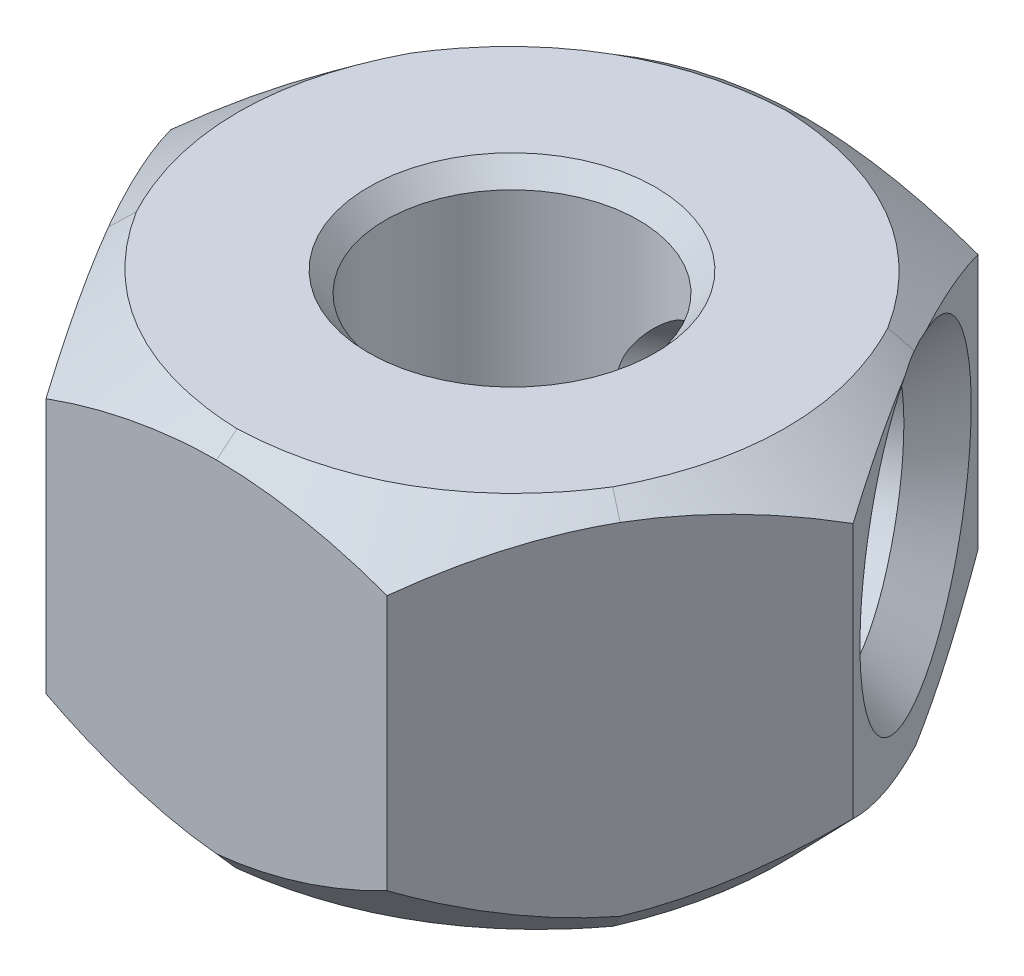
SolidWorks part; units mm, degrees
ref_plane "Front Plane" through (0, 0, 0) normal (0, 0, 1) x (1, 0, 0)
ref_plane "Top Plane" through (0, 0, 0) normal (0, 1, 0) x (1, 0, 0)
ref_plane "Right Plane" through (0, 0, 0) normal (1, 0, 0) x (0, 0, -1)
sketch "Sketch1" plane through (0, 0, 0) normal (0, 1, 0) x (1, 0, 0)
  line L1 (4.0415, 0) -> (2.0207, 3.5)
  line L2 (2.0207, 3.5) -> (-2.0207, 3.5)
  line L3 (-2.0207, 3.5) -> (-4.0415, 0)
  line L4 (-4.0415, 0) -> (-2.0207, -3.5)
  line L5 (-2.0207, -3.5) -> (2.0207, -3.5)
  line L6 (2.0207, -3.5) -> (4.0415, 0)
  circle A0 centre (0, 0) radius 3.5 construction
  circle A1 centre (0, 0) radius 1.5
  dimension "D1" = 7
  dimension "D2" = 3
extrude "Boss-Extrude1" add sketch "Sketch1" along normal blind 4.5
chamfer "Chamfer1" distance 0.2 angle 50 14 edges at (0, 0, 1.5) (3.0311, 0, -1.75) (0, 0, -3.5) (-3.0311, 0, -1.75) (-3.0311, 0, 1.75) (0, 0, 3.5) (3.0311, 0, 1.75) (0, 4.5, 1.5) (0, 4.5, 3.5) (-3.0311, 4.5, 1.75) (-3.0311, 4.5, -1.75) (0, 4.5, -3.5) (3.0311, 4.5, -1.75) (3.0311, 4.5, 1.75)
sketch "Sketch2" plane through (3.0311, 0, -1.75) normal (0.866, 0, -0.5) x (-0.5, 0, -0.866)
  circle A0 centre (0, 2.5192) radius 1.4
  dimension "D1" = 2.8
extrude "Cut-Extrude1" cut sketch "Sketch2" against normal blind 3
chamfer "Chamfer2" distance 0.4 angle 50 1 edges at (2.3311, 2.5192, -2.9624)
fillet "Fillet1" radius 5.5 12 edges at (-3.926, 0.1192, 0) (-1.963, 0.1192, -3.4) (1.963, 0.1192, -3.4) (3.926, 0.1192, 0) (1.963, 0.1192, 3.4) (-1.963, 0.1192, 3.4) (1.9519, 4.4, -3.3808) (-1.9519, 4.4, -3.3808) (-3.9038, 4.4, 0) (3.9038, 4.4, 0) (1.9519, 4.4, 3.3808) (-1.9519, 4.4, 3.3808)
